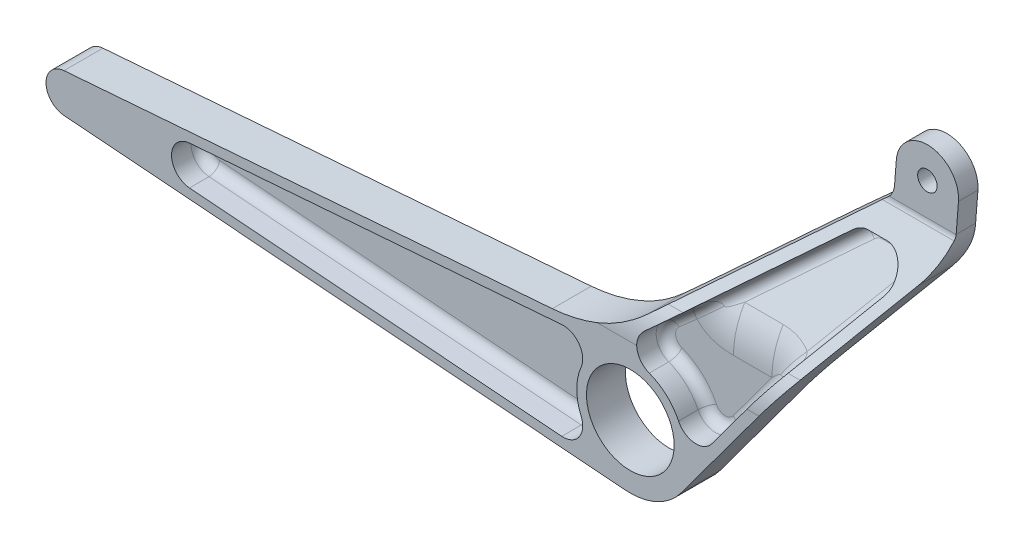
SolidWorks part; units mm, degrees
ref_plane "Front Plane" through (0, 0, 0) normal (0, 0, 1) x (1, 0, 0)
ref_plane "Top Plane" through (0, 0, 0) normal (0, 1, 0) x (1, 0, 0)
ref_plane "Right Plane" through (0, 0, 0) normal (1, 0, 0) x (0, 0, -1)
sketch "Sketch1" plane through (0, 0, 0) normal (0, 0, 1) x (1, 0, 0)
  line L0 (0, 0) -> (-190.5, 0) construction
  line L1 (0, 0) -> (8.195, 11.7036) construction
  line L2 (-184.6427, -6.3309) -> (-1.6012, -20.5753)
  line L3 (-184.6427, 6.3309) -> (-8.4852, 20.0396)
  line L4 (68.4154, 87.5677) -> (67.3639, 74.0557) construction
  line L5 (67.3639, 74.0557) -> (0, 0) construction
  line L6 (58.286, 88.356) -> (57.5047, 78.3161)
  line L7 (68.4154, 87.5677) -> (0, 0) construction
  line L8 (78.5448, 86.7794) -> (77.223, 69.7953)
  line L10 (77.223, 69.7953) -> (16.5989, -12.2631)
  line L11 (57.5047, 78.3161) -> (-8.4852, 20.0396)
  line L12 (77.223, 69.7953) -> (7.5157, -6.8366) construction
  line L13 (57.5047, 78.3161) -> (-7.5157, 6.8366) construction
  circle A0 centre (0, 0) radius 14.2875
  circle A1 centre (68.4154, 87.5677) radius 3.175
  arc A2 (-184.6427, 6.3309) -> (-184.6427, -6.3309) centre (-184.15, 0) ccw
  arc A3 (-1.6012, -20.5753) -> (16.5989, -12.2631) centre (0, 0) ccw
  arc A4 (58.286, 88.356) -> (78.5448, 86.7794) centre (68.4154, 87.5677) cw
  circle A5 centre (0, 0) radius 20.6375 construction
  circle A7 centre (68.4154, 87.5677) radius 10.16 construction
  dimension "D1" = 28.575
  dimension "D5" = 6.35
  dimension "D6" = 12.7
  dimension "D8" = 10.16
  dimension "D2" = 20.32
  dimension "D3" = 190.5
  dimension "D4" = 111.125
  dimension "D10" = 128
  dimension "D7" = 6.35
  dimension "D9" = 10.16
extrude "Boss-Extrude1" add sketch "Sketch1" along normal blind 12.7 contours A4 L6 L11 L3 A2 L2 A3 L10 L8 A1 A0
ref_plane "Plane1" through (0, 0, -15.6845) normal (0, 0, -1) x (-1, 0, 0)
sketch "Sketch9" plane through (0, 0, 0) normal (0, 0, -1) x (-1, 0, 0)
  line L0 (-49.1154, 31.75) -> (-4.7752, 31.75)
  line L6 (-78.5448, 86.7794) -> (-77.223, 69.7953)
  line L7 (-77.223, 69.7953) -> (-16.5989, -12.2631)
  line L8 (1.6012, -20.5753) -> (184.6427, -6.3309)
  line L9 (184.6427, 6.3309) -> (8.4852, 20.0396)
  line L10 (8.4852, 20.0396) -> (-57.5047, 78.3161)
  line L11 (-57.5047, 78.3161) -> (-58.286, 88.356)
  line L12 (-78.5448, 86.7794) -> (-77.223, 69.7953)
  line L13 (-77.223, 69.7953) -> (-16.5989, -12.2631)
  line L14 (1.6012, -20.5753) -> (184.6427, -6.3309)
  line L15 (184.6427, 6.3309) -> (8.4852, 20.0396)
  line L16 (8.4852, 20.0396) -> (-57.5047, 78.3161)
  line L17 (-57.5047, 78.3161) -> (-58.286, 88.356)
  arc A3 (-58.286, 88.356) -> (-78.5448, 86.7794) centre (-68.4154, 87.5677) ccw
  arc A4 (-16.5989, -12.2631) -> (1.6012, -20.5753) centre (0, 0) ccw
  arc A5 (184.6427, -6.3309) -> (184.6427, 6.3309) centre (184.15, 0) ccw
  arc A6 (-58.286, 88.356) -> (-78.5448, 86.7794) centre (-68.4154, 87.5677) ccw
  arc A7 (-16.5989, -12.2631) -> (1.6012, -20.5753) centre (0, 0) ccw
  arc A8 (184.6427, -6.3309) -> (184.6427, 6.3309) centre (184.15, 0) ccw
  dimension "D2" = 31.75
  dimension "D1" = 0
extrude "Boss-Extrude4" add sketch "Sketch9" along normal blind 22.098 contours L0 M13 M18 M19 M11 M12 M20
sketch "Sketch10" plane through (0, 0, 0) normal (1, 0, 0) x (0, 0, -1)
  line L0 (0, 31.75) -> (22.098, 68.2113)
  line L1 (22.098, 86.7794) -> (22.098, 69.7953) construction
  line L2 (22.098, 68.2113) -> (22.098, 31.75)
  line L3 (22.098, 31.75) -> (0, 31.75) construction
  line L4 (22.098, 31.75) -> (0, 31.75)
  line L5 (-12.7, 29.1724) -> (15.748, 76.1111)
  line L7 (-12.7, 69.7953) -> (-12.7, -12.2631) construction
  line L8 (15.748, 97.7277) -> (15.748, 76.1111)
  line L9 (22.098, 97.7277) -> (-12.7, 97.7277) construction
  line L10 (15.748, 97.7277) -> (-12.7, 97.7277)
  line L11 (-12.7, 97.7277) -> (-12.7, 86.7794) construction
  line L12 (-12.7, 97.7277) -> (-12.7, 26.3235)
  line L13 (22.098, 86.7794) -> (22.098, 97.7277) construction
  dimension "D1" = 9.525
  dimension "D2" = 6.35
extrude "Cut-Extrude5" cut sketch "Sketch10" against normal through all both and the other way through all contours L4 L2 L0
shell "Shell5" thickness 3.175
sketch "Sketch11" plane through (0, 0, 12.7) normal (0, 0, 1) x (1, 0, 0)
  line L0 (61.4514, 88.1096) -> (60.5703, 76.7876) construction
  line L1 (75.3793, 87.0258) -> (74.1283, 70.9495) construction
  line L2 (61.4514, 88.1096) -> (60.5703, 76.7876)
  line L3 (75.3793, 87.0258) -> (74.1283, 70.9495)
  line L4 (60.5703, 76.7876) -> (51.2947, 68.5961)
  line L5 (60.5703, 76.7876) -> (-7.1798, 16.9566) construction
  line L6 (51.2947, 68.5961) -> (72.3896, 68.5961)
  line L7 (74.1283, 70.9495) -> (14.0452, -10.3765) construction
  line L8 (72.3896, 68.5961) -> (74.1283, 70.9495)
  line L11 (-184.3963, 3.1654) -> (-7.1798, 16.9566) construction
  line L12 (-184.3963, -3.1654) -> (-1.3548, -17.4099) construction
  line L18 (14.0452, -10.3765) -> (45.8233, 32.637)
  line L19 (45.8233, 32.637) -> (10.5761, 32.637)
  line L20 (10.5761, 32.637) -> (-7.1798, 16.9566)
  line L21 (-7.1798, 16.9566) -> (-184.3963, 3.1654)
  line L22 (-184.3963, -3.1654) -> (-1.3548, -17.4099)
  line L23 (14.0452, -10.3765) -> (45.8233, 32.637)
  line L24 (45.8233, 32.637) -> (10.5761, 32.637)
  line L25 (10.5761, 32.637) -> (-7.1798, 16.9566)
  line L26 (-7.1798, 16.9566) -> (-184.3963, 3.1654)
  line L27 (-184.3963, -3.1654) -> (-1.3548, -17.4099)
  arc A0 (75.3793, 87.0258) -> (61.4514, 88.1096) centre (68.4154, 87.5677) ccw construction
  arc A1 (75.3793, 87.0258) -> (61.4514, 88.1096) centre (68.4154, 87.5677) ccw
  circle A2 centre (8.4302, 22.2703) radius 6.35
  circle A3 centre (-21.8593, 9.445) radius 6.35
  arc A4 (14.0452, -10.3765) -> (-1.3548, -17.4099) centre (0, 0) ccw construction
  circle A5 centre (-143.2278, 0) radius 6.35
  arc A8 (14.0452, -10.3765) -> (-1.3548, -17.4099) centre (0, 0) ccw
  arc A9 (-184.3963, 3.1654) -> (-184.3963, -3.1654) centre (-184.15, 0) ccw
  arc A10 (14.0452, -10.3765) -> (-1.3548, -17.4099) centre (0, 0) ccw
  arc A11 (-184.3963, 3.1654) -> (-184.3963, -3.1654) centre (-184.15, 0) ccw
  circle A12 centre (68.4154, 87.5677) radius 6.35
  circle A13 centre (68.4154, 87.5677) radius 6.35
  dimension "D1" = 12.7
  dimension "D2" = 0
  dimension "D3" = 0
extrude "Boss-Extrude6" add sketch "Sketch11" against normal up to surface (31.623 mm away) contours L6 A13 M26 M21 M20 M19 M18
sketch "Sketch12" plane through (0, 0, 12.7) normal (0, 0, 1) x (1, 0, 0)
  line L1 (-184.3963, 3.1654) -> (-7.1798, 16.9566) construction
  line L2 (-184.3963, -3.1654) -> (-1.3548, -17.4099) construction
  line L3 (-184.3963, 3.1654) -> (-7.1798, 16.9566) construction
  line L4 (10.5761, 32.637) -> (-7.1798, 16.9566) construction
  line L10 (14.0452, -10.3765) -> (45.8233, 32.637)
  line L11 (45.8233, 32.637) -> (10.5761, 32.637)
  line L12 (10.5761, 32.637) -> (-7.1798, 16.9566)
  line L13 (-7.1798, 16.9566) -> (-184.3963, 3.1654)
  line L14 (-184.3963, -3.1654) -> (-1.3548, -17.4099)
  line L15 (14.0452, -10.3765) -> (45.8233, 32.637)
  line L16 (45.8233, 32.637) -> (10.5761, 32.637)
  line L17 (10.5761, 32.637) -> (-7.1798, 16.9566)
  line L18 (-7.1798, 16.9566) -> (-184.3963, 3.1654)
  line L19 (-184.3963, -3.1654) -> (-1.3548, -17.4099)
  circle A0 centre (8.4302, 22.2703) radius 6.35
  circle A1 centre (-21.8593, 9.445) radius 6.35
  circle A2 centre (-143.2278, 0) radius 6.35
  arc A3 (14.0452, -10.3765) -> (-1.3548, -17.4099) centre (0, 0) ccw construction
  arc A6 (14.0452, -10.3765) -> (-1.3548, -17.4099) centre (0, 0) ccw
  arc A7 (-184.3963, 3.1654) -> (-184.3963, -3.1654) centre (-184.15, 0) ccw
  arc A8 (14.0452, -10.3765) -> (-1.3548, -17.4099) centre (0, 0) ccw
  arc A9 (-184.3963, 3.1654) -> (-184.3963, -3.1654) centre (-184.15, 0) ccw
  dimension "D1" = 12.7
  dimension "D2" = 0
extrude "Boss-Extrude7" add sketch "Sketch12" against normal up to surface (9.525 mm away) contours A2 L19 M14 M13 | A1 A0 L18 M11 M8
fillet "Fillet14" radius 6.35 4 edges at (51.2947, 68.5961, -2.9593) (72.3896, 68.5961, -2.9593) (-1.3548, -17.4099, 7.9375) (14.0452, -10.3765, 7.9375)
fillet "Fillet15" radius 3.175 16 edges at (-83.0362, 11.0534, 3.175) (-149.5778, 0, 3.175) (-83.0362, -11.0534, 3.175) (-16.6923, -13.1361, 3.175) (-17.4625, 0, 3.175) (36.1915, 19.5998, 3.175) (20.8586, 4.0137, 3.175) (11.7985, 12.8738, 3.175) (2.1837, 21.1287, 3.175) (55.3669, 45.5549, -4.6541) (30.035, 49.8214, -7.2399) (51.4501, 68.1852, -18.3696) (56.7502, 68.5961, -18.6186) (-16.6923, 13.1361, 3.175) (7.4015, 29.8335, 3.175) (65.4726, 65.1064, -16.5036)
sketch "Sketch13" plane through (0, 0, 0) normal (1, 0, 0) x (0, 0, -1)
  line L0 (-12.7, 29.1724) -> (15.748, 76.1111) construction
  line L1 (15.748, 97.7277) -> (15.748, 76.1111) construction
  line L2 (15.748, 97.7277) -> (-12.7, 97.7277) construction
  line L3 (22.098, 68.2113) -> (0, 31.75)
  line L4 (22.098, 31.75) -> (22.098, 68.2113)
  line L5 (0, 31.75) -> (22.098, 31.75)
  line L6 (22.098, 68.2113) -> (0, 31.75)
  line L7 (22.098, 31.75) -> (22.098, 68.2113)
  line L8 (0, 31.75) -> (22.098, 31.75)
  line L9 (-12.7, 97.7277) -> (-12.7, 26.3235) construction
  line L10 (-12.7, 29.1724) -> (15.748, 76.1111)
  line L11 (15.748, 97.7277) -> (15.748, 76.1111)
  line L12 (15.748, 97.7277) -> (-12.7, 97.7277)
  line L13 (-12.7, 97.7277) -> (-12.7, 26.3235)
  dimension "D1" = 0
extrude "Cut-Extrude6" cut sketch "Sketch13" against normal through all both and the other way through all contours L12 L13 L10 L11
fillet "Fillet16" radius 25.4 2 edges at (61.0576, 68.2113, -22.098)
fillet "Fillet17" radius 50.8 1 edges at (-8.4852, 20.0396, 6.35)
fillet "Fillet18" radius 25.4 2 edges at (4.1725, 29.1724, 12.7) (45.2374, 29.1724, 12.7)
fillet "Fillet20" radius 25.4 1 edges at (77.223, 69.7953, -16.7064)
fillet "Fillet21" radius 25.4 5 edges at (44.3402, 31.6517, 4.4824) (42.4439, 32.573, 3.2138) (14.566, 34.9199, 4.1049) (16.4608, 32.7585, 3.175) (29.5559, 32.637, 3.175)
sketch "Sketch14" plane through (0, 0, 12.7) normal (0, 0, 1) x (1, 0, 0)
  line L0 (-1.6012, -20.5753) -> (-188.058, -20.5753)
  line L1 (-184.6427, -6.3309) -> (-1.6012, -20.5753) construction
  line L2 (-184.6427, -6.3309) -> (-1.6012, -20.5753)
fillet "Fillet22" radius 3.175 1 edges at (66.3523, 76.1111, -15.748)
fillet "Fillet23" radius 6.35 1 edges at (57.5047, 78.3161, -18.923)
